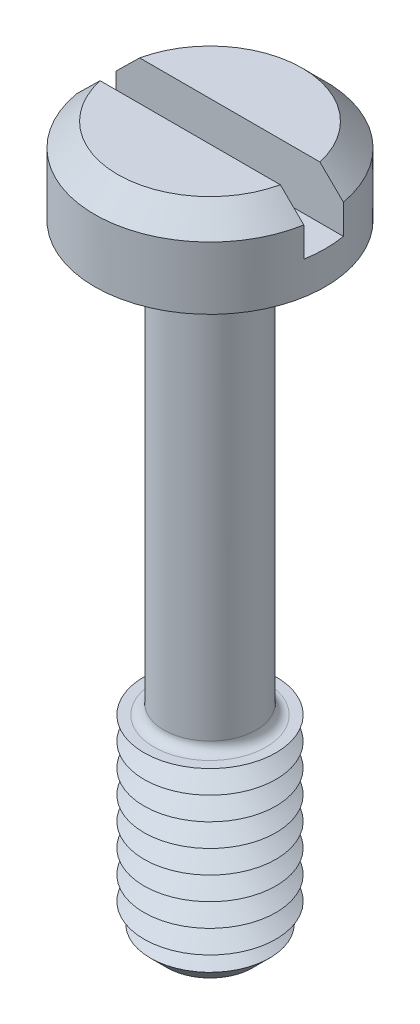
SolidWorks part; units mm, degrees
ref_plane "Front Plane" through (0, 0, 0) normal (0, 0, 1) x (1, 0, 0)
ref_plane "Top Plane" through (0, 0, 0) normal (0, 1, 0) x (1, 0, 0)
ref_plane "Right Plane" through (0, 0, 0) normal (1, 0, 0) x (0, 0, -1)
sketch "Sketch1" plane through (0, 0, 0) normal (0, 1, 0) x (1, 0, 0)
  circle A0 centre (0, 0) radius 3.5
  dimension "D1" = 7
extrude "Boss-Extrude1" add sketch "Sketch1" along normal blind 2.6
sketch "Sketch2" plane through (0, 0, 0) normal (0, -1, 0) x (1, 0, 0)
  circle A0 centre (0, 0) radius 1.4
  dimension "D1" = 2.8
extrude "Boss-Extrude2" add sketch "Sketch2" along normal blind 19
sketch "Sketch3" plane through (0, -19, 0) normal (0, -1, 0) x (1, 0, 0)
  circle A0 centre (0, 0) radius 2
  dimension "D1" = 4
extrude "Boss-Extrude3" add sketch "Sketch3" against normal blind 6
chamfer "Chamfer1" distance 0.7 angle 45 1 edges at (0, -19, -2)
sketch "Sketch4" plane through (0, 0, 0) normal (1, 0, 0) x (0, 0, -1)
  line L0 (0, -6.5871) -> (0, -12.0372) construction
sketch "Sketch5" plane through (0, 0, 0) normal (1, 0, 0) x (0, 0, -1)
  line L0 (-2, -13) -> (-1.3938, -13.35)
  line L1 (-1.3938, -13.35) -> (-2, -13.7)
  line L2 (-2, -13) -> (-2, -18.3) construction
  line L3 (-2, -13.7) -> (-2, -13)
  dimension "D1" = 0.7
revolve "Cut-Revolve1" cut sketch "Sketch5" angle 360 about L0
pattern_linear "LPattern1" count 8 spacing 0.7 along (0, -1, 0) of "Cut-Revolve1"
fillet "Fillet1" radius 0.3 2 edges at (0, -13, -1.4) (0, 0, -1.4)
chamfer "Chamfer2" distance 0.7 angle 45 1 edges at (0, 2.6, 3.5)
sketch "Sketch6" plane through (0, 2.6, 0) normal (0, 1, 0) x (1, 0, 0)
  line L1 (3.5, -0.6) -> (-3.5, -0.6)
  line L2 (3.5, -0.6) -> (3.5, 0.6)
  line L3 (3.5, 0.6) -> (-3.5, 0.6)
  line L4 (-3.5, -0.6) -> (-3.5, 0.6)
  line L5 (3.5, -0.6) -> (-3.5, 0.6) construction
  line L6 (3.5, 0.6) -> (-3.5, -0.6) construction
  circle A0 centre (0, 0) radius 3.5 construction
  point P0 (0, 0)
  dimension "D1" = 1.2
extrude "Cut-Extrude1" cut sketch "Sketch6" against normal blind 1.6
